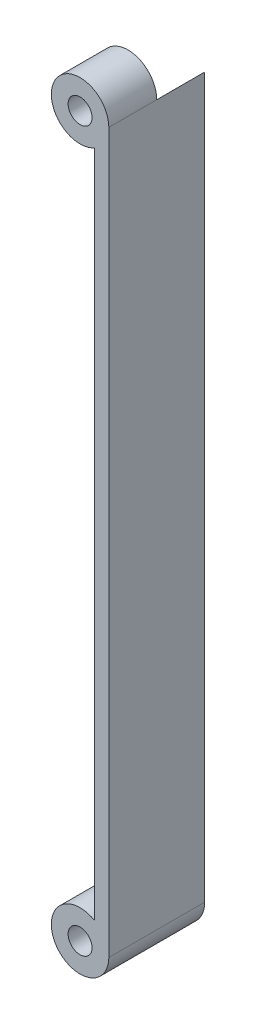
SolidWorks part; units mm, degrees
ref_plane "Plan de face" through (0, 0, 0) normal (0, 0, 1) x (1, 0, 0)
ref_plane "Plan de dessus" through (0, 0, 0) normal (0, 1, 0) x (1, 0, 0)
ref_plane "Plan de droite" through (0, 0, 0) normal (1, 0, 0) x (0, 0, -1)
sketch "Esquisse1" plane through (0, 0, 0) normal (0, 0, 1) x (1, 0, 0)
  line L0 (6, 150) -> (6, 0)
  line L1 (3, 144.8038) -> (3, 5.1962)
  circle A0 centre (0, 0) radius 2.5
  circle A1 centre (0, 150) radius 2.5
  arc A2 (6, 150) -> (3, 144.8038) centre (0, 150) ccw
  arc A3 (3, 5.1962) -> (6, 0) centre (0, 0) ccw
extrude "Boss.-Extru.1" add sketch "Esquisse1" along normal blind 20
sketch "Esquisse2" plane through (0, 0, 0) normal (0, 0, -1) x (-1, 0, 0)
  circle A0 centre (0, 150) radius 6
  dimension "D1" = 12
extrude "Enlèv. mat.-Extru.1" cut sketch "Esquisse2" against normal blind 10
equation "\"D3@Esquisse1\"=\"D2@Esquisse1\""
